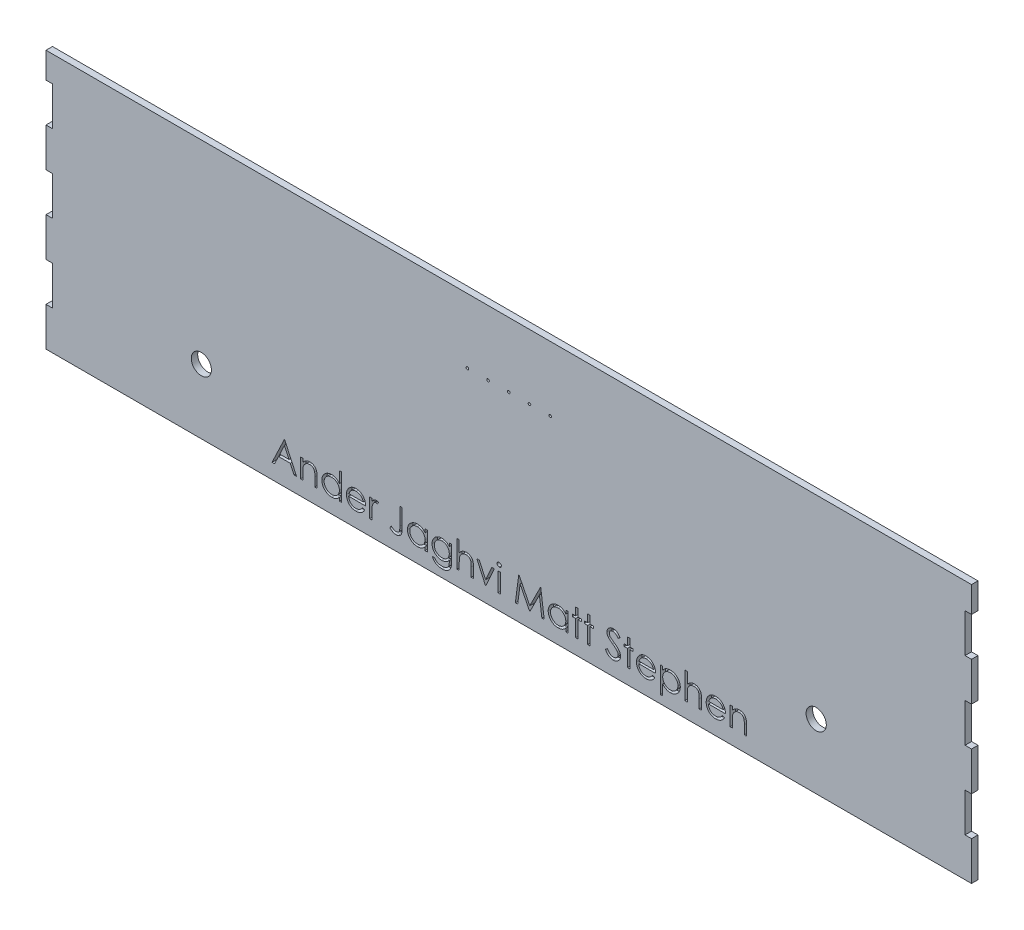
SolidWorks part; units mm, degrees
ref_plane "Front Plane" through (0, 0, 0) normal (0, 0, 1) x (1, 0, 0)
ref_plane "Top Plane" through (0, 0, 0) normal (0, 1, 0) x (1, 0, 0)
ref_plane "Right Plane" through (0, 0, 0) normal (1, 0, 0) x (0, 0, -1)
sketch "Sketch1" plane through (0, 0, 0) normal (0, 0, 1) x (1, 0, 0)
  line L0 (0, 0) -> (0, 19.05)
  line L1 (0, 127) -> (454.025, 127)
  line L2 (227.0125, 127) -> (227.0125, 0) construction
  line L3 (454.025, 0) -> (0, 0)
  line L4 (0, 0) -> (0, 19.05) construction
  line L5 (0, 19.05) -> (3.175, 19.05)
  line L6 (3.175, 19.05) -> (3.175, 38.1)
  line L7 (3.175, 38.1) -> (0, 38.1)
  line L8 (0, 38.1) -> (0, 57.15) construction
  line L9 (0, 57.15) -> (3.175, 57.15)
  line L10 (3.175, 57.15) -> (3.175, 76.2)
  line L11 (3.175, 76.2) -> (0, 76.2)
  line L12 (0, 76.2) -> (0, 95.25) construction
  line L13 (0, 95.25) -> (3.175, 95.25)
  line L14 (3.175, 95.25) -> (3.175, 114.3)
  line L15 (3.175, 114.3) -> (0, 114.3)
  line L16 (0, 114.3) -> (0, 127)
  line L17 (0, 76.2) -> (0, 95.25)
  line L18 (0, 38.1) -> (0, 57.15)
  line L19 (454.025, 76.2) -> (454.025, 95.25) construction
  line L20 (454.025, 38.1) -> (454.025, 57.15) construction
  line L21 (454.025, 0) -> (454.025, 19.05) construction
  line L22 (454.025, 38.1) -> (454.025, 57.15)
  line L23 (454.025, 76.2) -> (454.025, 95.25)
  line L24 (454.025, 114.3) -> (454.025, 127)
  line L25 (450.85, 114.3) -> (454.025, 114.3)
  line L26 (450.85, 95.25) -> (450.85, 114.3)
  line L27 (454.025, 95.25) -> (450.85, 95.25)
  line L28 (450.85, 76.2) -> (454.025, 76.2)
  line L29 (450.85, 57.15) -> (450.85, 76.2)
  line L30 (454.025, 57.15) -> (450.85, 57.15)
  line L31 (450.85, 38.1) -> (454.025, 38.1)
  line L32 (450.85, 19.05) -> (450.85, 38.1)
  line L33 (454.025, 19.05) -> (450.85, 19.05)
  line L34 (454.025, 0) -> (454.025, 19.05)
  line L35 (93.284, 95.25) -> (338.0654, 95.25) construction
  line L36 (0, 31.75) -> (467.3712, 31.75) construction
  line L37 (76.2, 0) -> (76.2, 136.1734) construction
  circle A0 centre (227.0125, 95.25) radius 0.635
  circle A1 centre (237.1725, 95.25) radius 0.635
  circle A2 centre (247.3325, 95.25) radius 0.635
  circle A3 centre (216.8525, 95.25) radius 0.635
  circle A4 centre (206.6925, 95.25) radius 0.635
  circle A5 centre (76.2, 31.75) radius 4.953
  circle A6 centre (377.825, 31.75) radius 4.953
  dimension "D7" = 3
  dimension "D9" = 1.27
  dimension "D10" = 76.2
  dimension "D11" = 31.75
  dimension "D12" = 9.906
  dimension "D1" = 127
  dimension "D2" = 454.025
  dimension "D3" = 3.175
  dimension "D4" = 19.05
  dimension "D5" = 19.05
  dimension "D6" = 95.25
  dimension "D8" = 3
extrude "Boss-Extrude1" add sketch "Sketch1" along normal blind 3.175
sketch "Sketch3" plane through (0, 0, 3.175) normal (0, 0, 1) x (1, 0, 0)
  text T0 "Ander Jaghvi Matt Stephen  " font "Century Gothic" height in points 48
extrude "Cut-Extrude1" cut sketch "Sketch3" against normal blind 2.54
